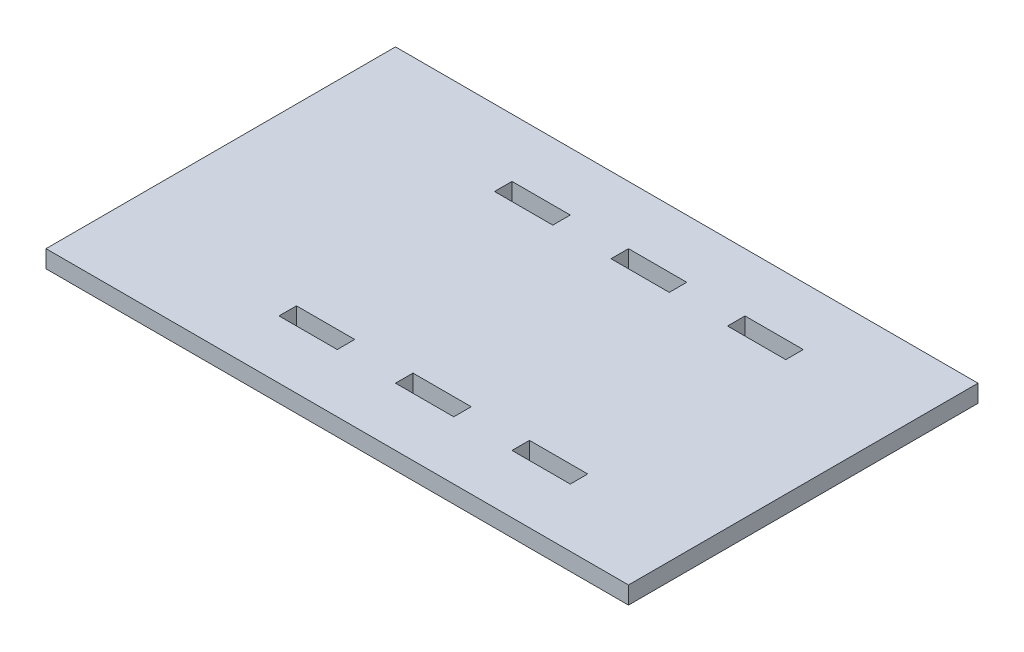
SolidWorks part; units mm, degrees
ref_plane "Front Plane" through (0, 0, 0) normal (0, 0, 1) x (1, 0, 0)
ref_plane "Top Plane" through (0, 0, 0) normal (0, 1, 0) x (1, 0, 0)
ref_plane "Right Plane" through (0, 0, 0) normal (1, 0, 0) x (0, 0, -1)
sketch "Sketch1" plane through (0, 0, 0) normal (0, 1, 0) x (1, 0, 0)
  line L1 (-250, -150) -> (250, -150)
  line L2 (-250, -150) -> (-250, 150)
  line L3 (-250, 150) -> (250, 150)
  line L4 (250, -150) -> (250, 150)
  line L5 (-250, -150) -> (250, 150) construction
  line L6 (-250, 150) -> (250, -150) construction
  point P0 (0, 0)
  dimension "D1" = 300
  dimension "D2" = 500
extrude "Boss-Extrude1" add sketch "Sketch1" along normal blind 15
sketch "Sketch2" plane through (0, 15, 0) normal (0, 1, 0) x (1, 0, 0)
  line L0 (-250, 150) -> (-250, -150) construction
  line L1 (-100, -85) -> (-50, -85)
  line L3 (-100, -100) -> (-50, -100)
  line L9 (-140, 243.1091) -> (-140, -262.0866) construction
  line L10 (-250, -150) -> (250, -150) construction
  line L11 (-100, -85) -> (-100, -100)
  line L12 (-50, -85) -> (-50, -100)
  line L13 (0, -85) -> (0, -100)
  line L14 (50, -85) -> (50, -100)
  line L19 (0, -100) -> (50, -100)
  line L20 (0, -85) -> (50, -85)
  line L25 (-318.9676, 0) -> (307.9463, 0) construction
  line L48 (100, -85) -> (100, -100)
  line L50 (150, -85) -> (150, -100)
  line L51 (100, -100) -> (150, -100)
  line L52 (100, -85) -> (150, -85)
  line L78 (200, -85) -> (200, -100)
  line L79 (250, -85) -> (250, -100)
  line L80 (200, -100) -> (250, -100)
  line L81 (200, -85) -> (250, -85)
  line L82 (300, -85) -> (300, -100)
  line L83 (300, -100) -> (350, -100)
  line L84 (300, -85) -> (350, -85)
  line L85 (350, -85) -> (350, -100)
  line L86 (100, 85) -> (150, 85)
  line L87 (100, 100) -> (150, 100)
  line L88 (150, 85) -> (150, 100)
  line L89 (100, 85) -> (100, 100)
  line L90 (0, 85) -> (50, 85)
  line L91 (0, 100) -> (50, 100)
  line L92 (50, 85) -> (50, 100)
  line L93 (0, 85) -> (0, 100)
  line L94 (-50, 85) -> (-50, 100)
  line L95 (-100, 85) -> (-100, 100)
  line L96 (-100, 100) -> (-50, 100)
  line L97 (-100, 85) -> (-50, 85)
  dimension "D1" = 50
  dimension "D2" = 15
  dimension "D3" = 50
  dimension "D4" = 4
  dimension "D5" = 50
  dimension "D6" = 50
  dimension "D8" = 110
  dimension "D9" = 40
  dimension "D7" = 50
  dimension "D10" = 50
extrude "Cut-Extrude1" cut sketch "Sketch2" against normal blind 15
